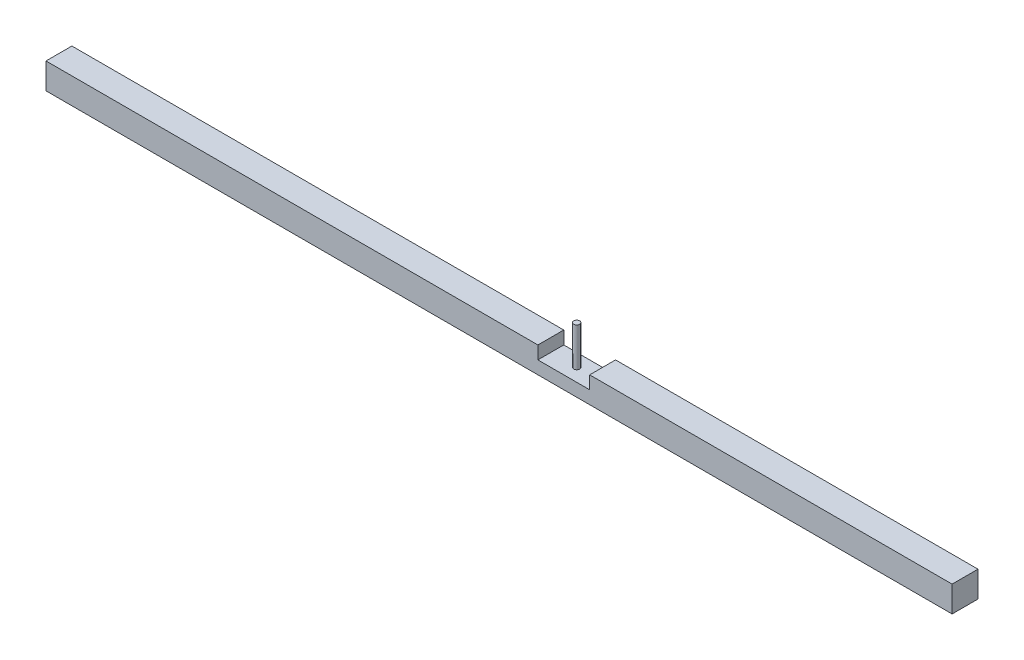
SolidWorks part; units mm, degrees
ref_plane "Front Plane" through (0, 0, 0) normal (0, 0, 1) x (1, 0, 0)
ref_plane "Top Plane" through (0, 0, 0) normal (0, 1, 0) x (1, 0, 0)
ref_plane "Right Plane" through (0, 0, 0) normal (1, 0, 0) x (0, 0, -1)
ref_plane "Plane1" through (0, 0, 0) normal (1, 0, 0) x (0, -1, 0)
sketch "Sketch1" plane through (0, 0, 0) normal (1, 0, 0) x (0, -1, 0)
  line L0 (-12.7, 12.7) -> (12.7, 12.7)
  line L1 (12.7, 12.7) -> (12.7, -12.7)
  line L2 (12.7, -12.7) -> (-12.7, -12.7)
  line L3 (-12.7, -12.7) -> (-12.7, 12.7)
  line L4 (0, -13.97) -> (0, 13.97) construction
  point P4 (0, 0)
  dimension "D1" = 25.4
  dimension "D2" = 25.4
extrude "Extrude1" add sketch "Sketch1" against normal blind 508 and the other way blind 381
ref_plane "Plane2" through (0, 0, 0) normal (0, 0, 1) x (0, -1, 0)
sketch "Sketch2" plane through (0, 0, 0) normal (0, 0, 1) x (0, -1, 0)
  line L0 (-12.7, 25.4) -> (0, 25.4)
  line L1 (0, 25.4) -> (0, -25.4)
  line L2 (0, -25.4) -> (-12.7, -25.4)
  line L3 (-12.7, -25.4) -> (-12.7, 25.4)
  line L4 (-13.335, 0) -> (0.635, 0) construction
extrude "Cut-Extrude1" cut sketch "Sketch2" against normal mid plane 25.4
sketch "Sketch3" plane through (0, 0, 0) normal (0, 1, 0) x (-1, 0, 0)
  line L0 (-3.4925, 0) -> (3.4925, 0) construction
  circle A0 centre (0, 0) radius 2.921
  dimension "D1" = 5.842
extrude "Extrude2" add sketch "Sketch3" along normal blind 38.1
